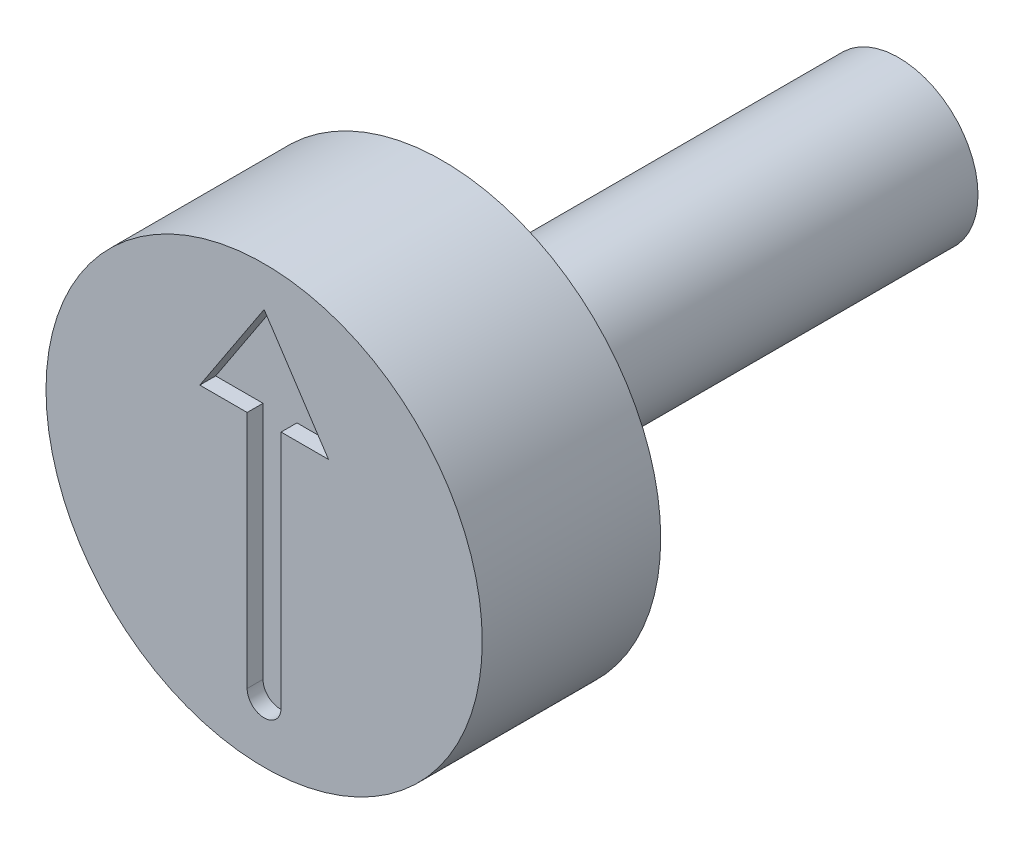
SolidWorks part; units mm, degrees
ref_plane "Front Plane" through (0, 0, 0) normal (0, 0, 1) x (1, 0, 0)
ref_plane "Top Plane" through (0, 0, 0) normal (0, 1, 0) x (1, 0, 0)
ref_plane "Right Plane" through (0, 0, 0) normal (1, 0, 0) x (0, 0, -1)
sketch "Sketch2" plane through (0, 0, 0) normal (0, 1, 0) x (1, 0, 0)
  line L5 (5.5, 0) -> (5.5, 4.5)
  line L6 (5.5, 4.5) -> (2, 4.5)
  line L7 (2, 4.5) -> (2, 16)
  line L8 (2, 16) -> (0, 16)
  line L9 (0, 0) -> (5.5, 0)
  line L10 (0, 0) -> (0, 50000) construction
  line L11 (0, 16) -> (0, 0)
  dimension "D1" = 4.5
  dimension "D2" = 16
  dimension "D3" = 11
  dimension "D4" = 4
revolve "Revolve1" add sketch "Sketch2" angle 360 about L10
sketch "Sketch3" plane through (0, 0, 0) normal (0, 0, 1) x (1, 0, 0)
  line L0 (-0.428, 2.0367) -> (-1.6222, 2.0367)
  line L1 (0, -0.9219) -> (0, 0.9385) construction
  line L2 (-0.428, -3.9912) -> (-0.428, 2.0367)
  line L3 (-1.6222, 2.0367) -> (0, 4.4989)
  line L12 (1.6222, 2.0367) -> (0, 4.4989)
  line L16 (0.428, -3.9912) -> (0.428, 2.0367)
  line L17 (0.428, 2.0367) -> (1.6222, 2.0367)
  arc A2 (-0.428, -3.9912) -> (0.428, -3.9912) centre (0, -3.9912) ccw
extrude "Cut-Extrude1" cut sketch "Sketch3" against normal blind 0.4
